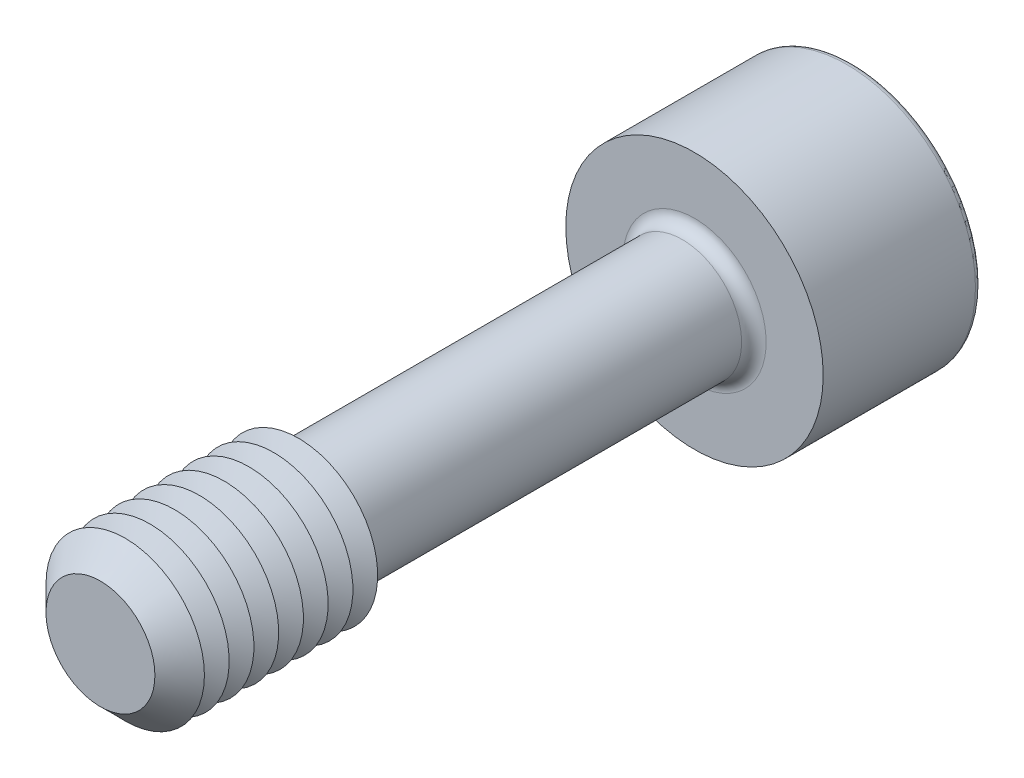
SolidWorks part; units mm, degrees
ref_plane "Front Plane" through (0, 0, 0) normal (0, 0, 1) x (1, 0, 0)
ref_plane "Top Plane" through (0, 0, 0) normal (0, 1, 0) x (1, 0, 0)
ref_plane "Right Plane" through (0, 0, 0) normal (1, 0, 0) x (0, 0, -1)
sketch "Sketch1" plane through (0, 0, 0) normal (0, 0, 1) x (1, 0, 0)
  circle A0 centre (0, 0) radius 3
  dimension "D1" = 6
extrude "Extrude1" add sketch "Sketch1" along normal mid plane 30
sketch "Sketch2" plane through (0, 0, 0) normal (1, 0, 0) x (0, 0, -1)
  line L0 (-15, 0) -> (-15, 4)
  line L1 (-15, 3) -> (-15, -3) construction
  line L2 (-15, 4) -> (-5, 4)
  line L3 (-5, 4) -> (-4.4226, 3)
  line L4 (15, 3) -> (-15, 3) construction
  line L5 (-4.4226, 3) -> (-4.4226, 0)
  line L6 (-4.4226, 0) -> (-15, 0)
  dimension "D1" = 4
  dimension "D2" = 120
  dimension "D3" = 10
revolve "Revolve1" add sketch "Sketch2" angle 360 about L6
chamfer "Chamfer1" distance 1.25 angle 45 1 edges at (0, 4, 15)
sketch "Sketch3" plane through (0, 0, -15) normal (0, 0, -1) x (-1, 0, 0)
  circle A0 centre (0, 0) radius 6.5
  dimension "D1" = 13
extrude "Extrude2" add sketch "Sketch3" along normal blind 8
sketch "Sketch4" plane through (-13.7, 0, -23) normal (0, 0, 1) x (1, 0, 0)
  line L2 (11.9679, -3) -> (15.4321, -3)
  line L3 (15.4321, -3) -> (17.1641, 0)
  line L4 (17.1641, 0) -> (15.4321, 3)
  line L6 (15.4321, 3) -> (11.9679, 3)
  line L7 (11.9679, 3) -> (10.2359, 0)
  line L8 (10.2359, 0) -> (11.9679, -3)
  circle A0 centre (13.7, 0) radius 3 construction
  dimension "D1" = 6
extrude "Extrude3" cut sketch "Sketch4" along normal blind 6
fillet "Fillet1" radius 0.62 1 edges at (-3, 0, -15)
fillet "Fillet2" radius 0.31 1 edges at (-6.5, 0, -23)
sketch "Sketch5" plane through (0, 0, 0) normal (1, 0, 0) x (0, 0, -1)
  line L0 (17, 0) -> (17, -3)
  line L1 (17, -3) -> (15.2679, 0)
  line L2 (15.2679, 0) -> (17, 0)
  dimension "D1" = 30
revolve "Cut-Revolve1" cut sketch "Sketch5" angle 360 about L2
sketch "Sketch6" plane through (0, 0, 0) normal (1, 0, 0) x (0, 0, -1)
  line L0 (1.332, 0) -> (-13.289, 0) construction
sketch "Sketch7" plane through (0, 0, 0) normal (1, 0, 0) x (0, 0, -1)
  line L0 (-5, 4) -> (-5.625, 2.9175)
  line L1 (-5.625, 2.9175) -> (-6.25, 4)
  line L2 (-5, 4) -> (-13.75, 4) construction
  line L3 (-6.25, 4) -> (-5, 4)
  dimension "D1" = 1.25
revolve "Cut-Revolve2" cut sketch "Sketch7" angle 360 about L0
pattern_linear "LPattern1" count 7 spacing 1.25 along (0, 0, 1) of "Cut-Revolve2"
